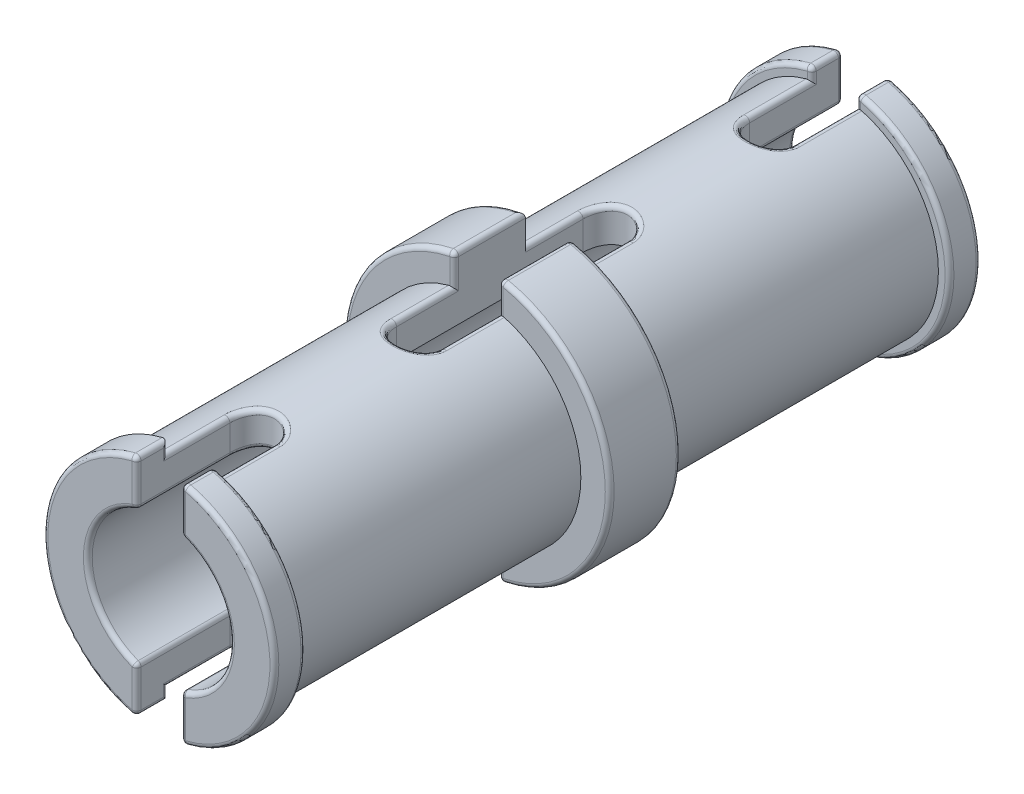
SolidWorks part; units mm, degrees
ref_plane "Front Plane" through (0, 0, 0) normal (0, 0, 1) x (1, 0, 0)
ref_plane "Top Plane" through (0, 0, 0) normal (0, 1, 0) x (1, 0, 0)
ref_plane "Right Plane" through (0, 0, 0) normal (1, 0, 0) x (0, 0, -1)
sketch "Sketch6" plane through (0, 0, 0) normal (0, 1, 0) x (1, 0, 0)
  line L0 (0, 0) -> (0, -11.8) construction
  line L1 (1.6, 0) -> (3, 0) construction
  line L3 (3, 0.8) -> (3, -0.8)
  line L4 (3, -0.8) -> (2.35, -0.8)
  line L5 (2.35, -0.8) -> (2.35, -7.25)
  line L6 (2.35, -7.25) -> (2.6, -7.25)
  line L7 (2.6, -7.25) -> (2.6, -7.95)
  line L8 (2.6, -7.95) -> (1.6, -7.95)
  line L9 (1.6, -7.95) -> (1.6, 7.95)
  line L10 (2.6, 7.95) -> (1.6, 7.95)
  line L11 (2.6, 7.25) -> (2.6, 7.95)
  line L12 (2.35, 7.25) -> (2.6, 7.25)
  line L13 (2.35, 0.8) -> (2.35, 7.25)
  line L14 (3, 0.8) -> (2.35, 0.8)
  dimension "D1" = 6.45
  dimension "D2" = 0.8
  dimension "D3" = 0.7
  dimension "D4" = 3
  dimension "D5" = 2.35
  dimension "D6" = 2.6
  dimension "D8" = 3.2
revolve "Revolve1" add sketch "Sketch6" angle 360 about L0
sketch "Sketch7" plane through (0, 0, 0) normal (0, 1, 0) x (1, 0, 0)
  line L0 (0, 2.1) -> (0, -2.1) construction
  line L1 (0.5, 2.1) -> (0.5, -2.1)
  line L2 (-0.5, 2.1) -> (-0.5, -2.1)
  line L3 (0, 10.05) -> (0, 5.85) construction
  line L4 (0.5, 10.05) -> (0.5, 5.85)
  line L5 (-0.5, 10.05) -> (-0.5, 5.85)
  line L6 (0, -5.85) -> (0, -10.05) construction
  line L7 (0.5, -5.85) -> (0.5, -10.05)
  line L8 (-0.5, -5.85) -> (-0.5, -10.05)
  arc A0 (0.5, 2.1) -> (-0.5, 2.1) centre (0, 2.1) ccw
  arc A1 (-0.5, -2.1) -> (0.5, -2.1) centre (0, -2.1) ccw
  arc A2 (0.5, 10.05) -> (-0.5, 10.05) centre (0, 10.05) ccw
  arc A3 (-0.5, 5.85) -> (0.5, 5.85) centre (0, 5.85) ccw
  arc A4 (0.5, -5.85) -> (-0.5, -5.85) centre (0, -5.85) ccw
  arc A5 (-0.5, -10.05) -> (0.5, -10.05) centre (0, -10.05) ccw
  point P2 (0, 0)
  point P10 (0, 7.95)
  point P17 (0, -7.95)
  dimension "D1" = 0.5
  dimension "D2" = 4.2
  dimension "D5" = 0.5
  dimension "D7" = 0.5
  dimension "D9" = 4.2
  dimension "D3" = 7.95
  dimension "D4" = 7.95
  dimension "D6" = 4.2
  dimension "D8" = 0.5
extrude "Cut-Extrude1" cut sketch "Sketch7" against normal mid plane 6
sketch "Sketch9" plane through (0, 0, 0.8) normal (0, 0, 1) x (1, 0, 0)
  line L0 (0, 0) -> (1.2807, 1.2807) construction
  line L1 (0, 0) -> (1.445, 0) construction
  line L2 (1.436, 1.8602) -> (1.8602, 1.436)
  arc A0 (1.436, 1.8602) -> (1.8602, 1.436) centre (1.2807, 1.2807) cw
  arc A1 (0.5, -2.2962) -> (0.5, 2.2962) centre (0, 0) ccw construction
  dimension "D2" = 0.6
  dimension "D1" = 45
  dimension "D3" = 0.6
fillet "Fillet4" radius 0.1 28 edges at (0.5, 2.6271, 0.8) (0.5, -2.6271, 0.8) (-0.5, -2.6271, 0.8) (-0.5, 2.6271, 0.8) (0.5, 2.2962, 1.45) (0.5, -2.2962, 1.45) (-0.0525, 2.3494, 2.5972) (0.0525, -2.3494, 2.5972) (-0.5, 2.2962, 1.45) (-0.5, -2.2962, 1.45) (3, 0, 0.8) (-3, 0, 0.8) (0.5, -2.958, 0) (0.5, 2.958, 0) (-0.5, 2.958, 0) (-0.5, -2.958, 0) (-0.5, 2.6271, -0.8) (-0.5, -2.6271, -0.8) (-0.5, -2.2962, -1.45) (-0.5, 2.2962, -1.45) (0.0525, 2.3494, -2.5972) (-0.0525, -2.3494, -2.5972) (0.5, 2.2962, -1.45) (0.5, -2.2962, -1.45) (0.5, -2.6271, -0.8) (0.5, 2.6271, -0.8) (-3, 0, -0.8) (3, 0, -0.8)
fillet "Fillet5" radius 0.1 59 edges at (-0.0464, 1.5993, 5.3522) (0.0464, -1.5993, 5.3522) (-0.5, 1.5199, 6.9) (-0.5, -1.5199, 6.9) (0.5, 1.5199, 6.9) (0.5, -1.5199, 6.9) (0.0525, 2.3494, 5.3528) (-0.0525, -2.3494, 5.3528) (-0.5, -2.2962, 6.55) (-0.5, 2.2962, 6.55) (0.5, 2.2962, 6.55) (0.5, -2.2962, 6.55) (-2.6, 0, 7.95) (2.6, 0, 7.95) (-0.5, 2.5515, 7.6) (-0.5, -2.5515, 7.6) (0.5, -2.5515, 7.6) (0.5, 2.5515, 7.6) (-1.6, 0, 7.95) (1.6, 0, 7.95) (-0.5, -2.0357, 7.95) (-0.5, 2.0357, 7.95) (0.5, 2.0357, 7.95) (0.5, -2.0357, 7.95) (2.6, 0, 7.25) (-0.5, 2.4238, 7.25) (-0.5, -2.4238, 7.25) (0.5, -2.4238, 7.25) (0.5, 2.4238, 7.25) (0.5, 1.5199, -6.9) (0.5, -1.5199, -6.9) (0.5, 2.2962, -6.55) (0.5, -2.2962, -6.55) (-0.5, -1.5199, -6.9) (-0.5, 1.5199, -6.9) (-0.5, 2.2962, -6.55) (-0.5, -2.2962, -6.55) (0.0464, 1.5993, -5.3522) (-0.0464, -1.5993, -5.3522) (-0.0525, 2.3494, -5.3528) (0.0525, -2.3494, -5.3528) (-0.5, 2.0357, -7.95) (-0.5, -2.0357, -7.95) (-1.6, 0, -7.95) (-2.6, 0, -7.95) (0.5, -2.0357, -7.95) (0.5, 2.0357, -7.95) (1.6, 0, -7.95) (2.6, 0, -7.95) (-0.5, 2.5515, -7.6) (-0.5, -2.5515, -7.6) (0.5, -2.5515, -7.6) (0.5, 2.5515, -7.6) (-0.5, -2.4238, -7.25) (-0.5, 2.4238, -7.25) (0.5, 2.4238, -7.25) (0.5, -2.4238, -7.25) (-2.6, 0, -7.25) (2.6, 0, -7.25)
